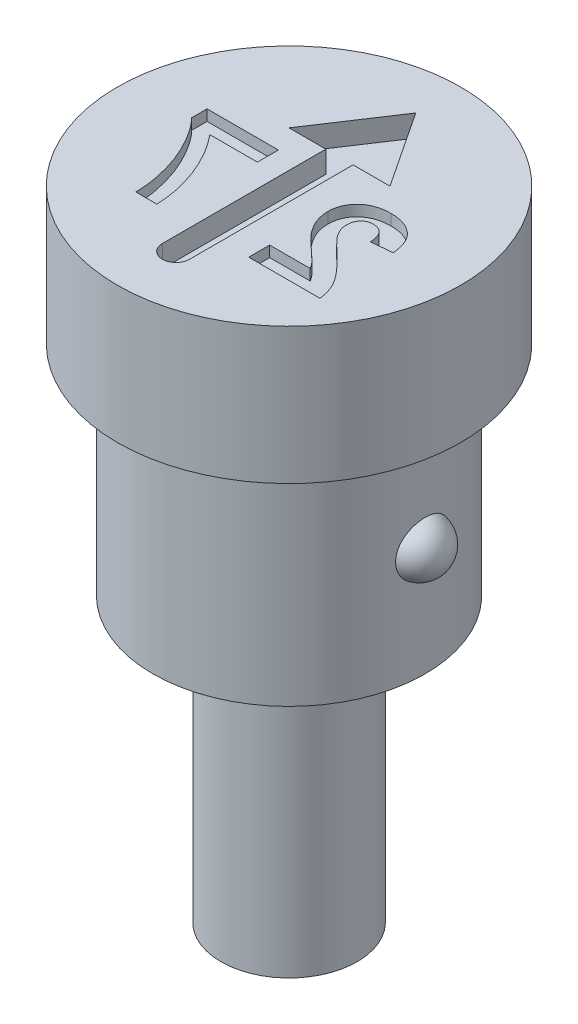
SolidWorks part; units mm, degrees
ref_plane "Front Plane" through (0, 0, 0) normal (0, 0, 1) x (1, 0, 0)
ref_plane "Top Plane" through (0, 0, 0) normal (0, 1, 0) x (1, 0, 0)
ref_plane "Right Plane" through (0, 0, 0) normal (1, 0, 0) x (0, 0, -1)
sketch "Sketch1" plane through (0, 0, 0) normal (0, 0, 1) x (1, 0, 0)
  line L0 (0, 0) -> (0, -11.7) construction
  line L1 (0, -3.465) -> (0, 3.465) construction
  line L2 (0, 0) -> (-3.15, 0)
  line L3 (-3.15, 0) -> (-3.15, -2.5)
  line L4 (-3.15, -2.5) -> (-2.5, -2.5)
  line L5 (-2.5, -2.5) -> (-2.5, -6.5)
  line L6 (-2.5, -6.5) -> (-1.25, -6.5)
  line L7 (-1.25, -6.5) -> (-1.25, -11.7)
  line L8 (-1.25, -11.7) -> (0, -11.7)
  line L9 (0, -11.7) -> (0, 0)
  dimension "D1" = 6.3
  dimension "D2" = 11.7
  dimension "D3" = 2.5
  dimension "D4" = 6.5
  dimension "D5" = 5
  dimension "D6" = 2.5
revolve "Revolve1" add sketch "Sketch1" angle 360 about L0
sketch "Sketch3" plane through (0, 0, 0) normal (0, 1, 0) x (1, 0, 0)
  line L0 (0, 2.325) -> (-0.9266, 0.925)
  line L1 (-0.9266, 0.925) -> (-0.25, 0.925)
  line L2 (-0.25, 0.925) -> (-0.25, -2.075)
  line L3 (0.25, -2.075) -> (0.25, 0.925)
  line L4 (0.25, 0.925) -> (0.9266, 0.925)
  line L5 (0.9266, 0.925) -> (0, 2.325)
  line L6 (0, 2.325) -> (0, -2.325) construction
  arc A0 (-0.25, -2.075) -> (0.25, -2.075) centre (0, -2.075) ccw
  dimension "D3" = 0.25
  dimension "D1" = 1.4
  dimension "D2" = 67
  dimension "D4" = 4.4
extrude "Cut-Extrude1" cut sketch "Sketch3" against normal blind 0.4
sketch "Sketch4" plane through (0, 0, 0) normal (0, 1, 0) x (1, 0, 0)
  text T0 "27" font "Arial" height 2
extrude "Cut-Extrude2" cut sketch "Sketch4" against normal blind 0.2
sketch "Sketch5" plane through (0, 0, 0) normal (0, 0, 1) x (1, 0, 0)
  line L2 (2.3885, -4) -> (2.3885, -5)
  line L3 (2.3885, -4) -> (2.3885, -5) construction
  line L4 (-2.5, -4.5) -> (2.3885, -4.5) construction
  line L5 (-2.5, -2.5) -> (-2.5, -6.5) construction
  arc A1 (2.3885, -5) -> (2.3885, -4) centre (2.3885, -4.5) ccw
  dimension "D1" = 0.5
revolve "Revolve2" add sketch "Sketch5" angle 360 about L2
